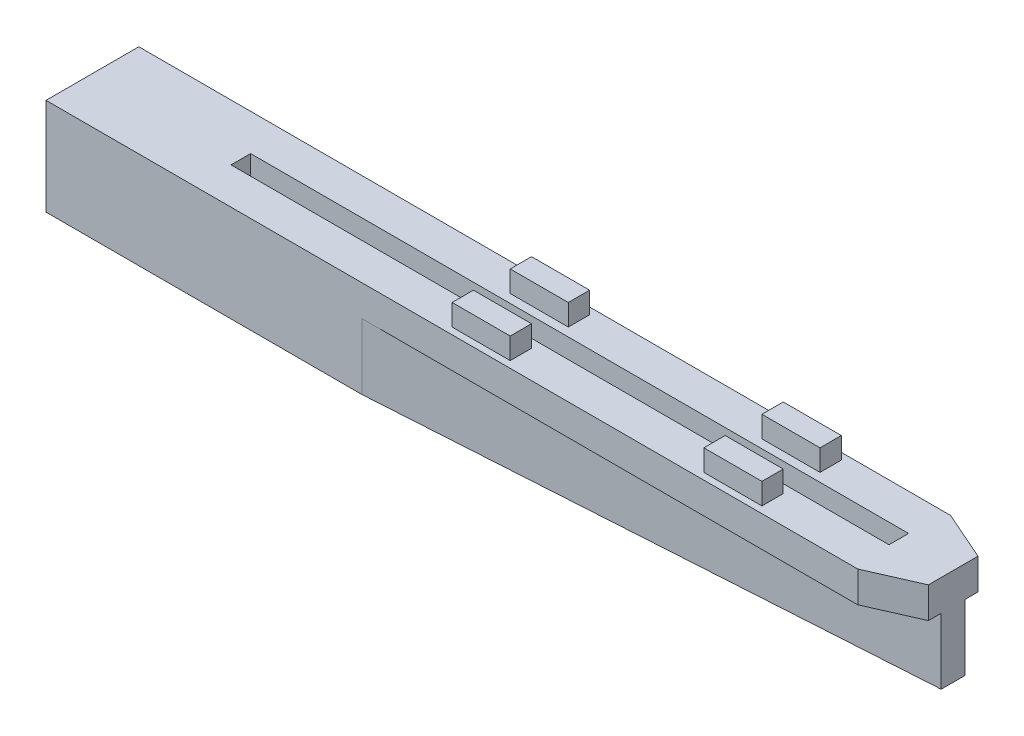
SolidWorks part; units mm, degrees
ref_plane "Front Plane" through (0, 0, 0) normal (0, 0, 1) x (1, 0, 0)
ref_plane "Top Plane" through (0, 0, 0) normal (0, 1, 0) x (1, 0, 0)
ref_plane "Right Plane" through (0, 0, 0) normal (1, 0, 0) x (0, 0, -1)
sketch "Sketch1" plane through (0, 0, 0) normal (0, 1, 0) x (1, 0, 0)
  line L0 (41.4561, 0.7876) -> (41.4561, 10.2876) construction
  line L1 (-69.1808, 17.52) -> (140.4332, 17.52)
  line L2 (-69.1808, 17.52) -> (-69.1808, -6.4447)
  line L3 (-69.1808, -6.4447) -> (140.4332, -6.4447)
  line L4 (153.0942, 11.9424) -> (153.0942, -0.8672)
  line L5 (33.9561, 0.7876) -> (48.9561, 0.7876) construction
  line L6 (33.9561, 10.2876) -> (48.9561, 10.2876) construction
  line L7 (41.4561, 5.5376) -> (13.5512, 5.5376) construction
  line L8 (153.0942, 5.5376) -> (23.5539, 5.5376) construction
  line L9 (-69.1808, 98.0376) -> (-69.1808, -86.9624) construction
  line L11 (140.4332, 17.52) -> (153.0942, 11.9424)
  line L12 (140.4332, -6.4447) -> (153.0942, -0.8672)
extrude "Boss-Extrude1" add sketch "Sketch1" along normal blind 5
sketch "Sketch2" plane through (0, 0, 0) normal (0, -1, 0) x (1, 0, 0)
  line L0 (153.0942, -5.5376) -> (143.3615, -5.5376) construction
  line L1 (139.0418, -8.0666) -> (-30.8596, -8.0666)
  line L2 (139.0418, -8.0666) -> (139.0418, -3.0087)
  line L3 (139.0418, -3.0087) -> (-30.8596, -3.0087)
  line L4 (-30.8596, -8.0666) -> (-30.8596, -3.0087)
  line L5 (153.0942, 0.8672) -> (153.0942, -11.9424) construction
  line L6 (139.0418, -5.5376) -> (124.9281, -5.5376) construction
extrude "Cut-Extrude1" cut sketch "Sketch2" against normal blind 26
sketch "Sketch3" plane through (0, 5, 0) normal (0, 1, 0) x (1, 0, 0)
  line L0 (98.9561, 10.2876) -> (113.9561, 10.2876) construction
  line L1 (98.9561, 15.7876) -> (98.9561, 10.2876) construction
  line L2 (113.9561, 15.7876) -> (113.9561, 10.2876) construction
  line L3 (98.9561, 15.7876) -> (113.9561, 15.7876) construction
  line L4 (98.9561, 10.2876) -> (113.9561, 10.2876)
  line L5 (98.9561, 15.7876) -> (98.9561, 10.2876)
  line L6 (113.9561, 15.7876) -> (113.9561, 10.2876)
  line L7 (98.9561, 15.7876) -> (113.9561, 15.7876)
  line L8 (113.9561, -4.7124) -> (113.9561, 0.7876) construction
  line L9 (98.9561, -4.7124) -> (113.9561, -4.7124) construction
  line L10 (98.9561, -4.7124) -> (98.9561, 0.7876) construction
  line L11 (98.9561, 0.7876) -> (113.9561, 0.7876) construction
  line L12 (113.9561, -4.7124) -> (113.9561, 0.7876)
  line L13 (98.9561, -4.7124) -> (113.9561, -4.7124)
  line L14 (98.9561, -4.7124) -> (98.9561, 0.7876)
  line L15 (98.9561, 0.7876) -> (113.9561, 0.7876)
  line L16 (33.9561, -4.7124) -> (33.9561, 0.7876) construction
  line L17 (33.9561, -4.7124) -> (48.9561, -4.7124) construction
  line L18 (48.9561, -4.7124) -> (48.9561, 0.7876) construction
  line L19 (33.9561, 0.7876) -> (48.9561, 0.7876) construction
  line L20 (33.9561, -4.7124) -> (33.9561, 0.7876)
  line L21 (33.9561, -4.7124) -> (48.9561, -4.7124)
  line L22 (48.9561, -4.7124) -> (48.9561, 0.7876)
  line L23 (33.9561, 0.7876) -> (48.9561, 0.7876)
  line L24 (33.9561, 15.7876) -> (33.9561, 10.2876) construction
  line L25 (48.9561, 15.7876) -> (48.9561, 10.2876) construction
  line L26 (33.9561, 15.7876) -> (48.9561, 15.7876) construction
  line L27 (33.9561, 10.2876) -> (48.9561, 10.2876) construction
  line L28 (33.9561, 15.7876) -> (33.9561, 10.2876)
  line L29 (48.9561, 15.7876) -> (48.9561, 10.2876)
  line L30 (33.9561, 15.7876) -> (48.9561, 15.7876)
  line L31 (33.9561, 10.2876) -> (48.9561, 10.2876)
extrude "Boss-Extrude2" add sketch "Sketch3" along normal up to surface (5.5 mm away)
sketch "Sketch4" plane through (0, 0, 0) normal (0, -1, 0) x (1, 0, 0)
  line L0 (140.4332, -17.52) -> (-69.1808, -17.52) construction
  line L1 (-69.1808, -17.52) -> (140.4332, -17.52)
  line L2 (-69.1808, -17.52) -> (-69.1808, 6.4447)
  line L3 (-69.1808, 6.4447) -> (140.4332, 6.4447)
  line L5 (-69.1808, -17.52) -> (-69.1808, 6.4447) construction
  line L7 (-30.8596, -8.0666) -> (-30.8596, -3.0087)
  line L8 (-30.8596, -3.0087) -> (139.0418, -3.0087)
  line L10 (-30.8596, -8.0666) -> (139.0418, -8.0666)
  line L25 (153.0942, -11.9424) -> (140.4332, -17.52) construction
  line L26 (153.0942, 0.8672) -> (153.0942, -11.9424) construction
  line L27 (140.4332, 6.4447) -> (153.0942, 0.8672) construction
  line L28 (153.0942, -11.9424) -> (140.4332, -17.52)
  line L29 (153.0942, 0.8672) -> (153.0942, -11.9424)
  line L30 (140.4332, 6.4447) -> (153.0942, 0.8672)
extrude "Boss-Extrude3" add sketch "Sketch4" along normal blind 20
sketch "Sketch7" plane through (0, -20, 0) normal (0, -1, 0) x (1, 0, 0)
  line L0 (153.0942, -5.5376) -> (159.943, -5.5376) construction
  line L1 (153.0942, -11.9424) -> (153.0942, 0.8672) construction
  line L5 (-69.1808, -17.52) -> (140.4332, -17.52) construction
  line L10 (140.4332, 6.4447) -> (-69.1808, 6.4447) construction
  line L12 (12.3871, -17.52) -> (140.4332, -17.52)
  line L13 (140.4332, -17.52) -> (153.0942, -11.9424)
  line L14 (153.0942, -11.9424) -> (153.0942, -8.6376)
  line L15 (153.0942, -2.4376) -> (153.0942, 0.8672)
  line L16 (153.0942, 0.8672) -> (140.4332, 6.4447)
  line L17 (140.4332, 6.4447) -> (12.3871, 6.4447)
  line L21 (153.0942, -8.6376) -> (12.3871, -17.52)
  line L22 (153.0942, -2.4376) -> (12.3871, 6.4447)
  dimension "D1" = 3.1
  dimension "D2" = 3.1
extrude "Cut-Extrude5" cut sketch "Sketch7" against normal blind 17
